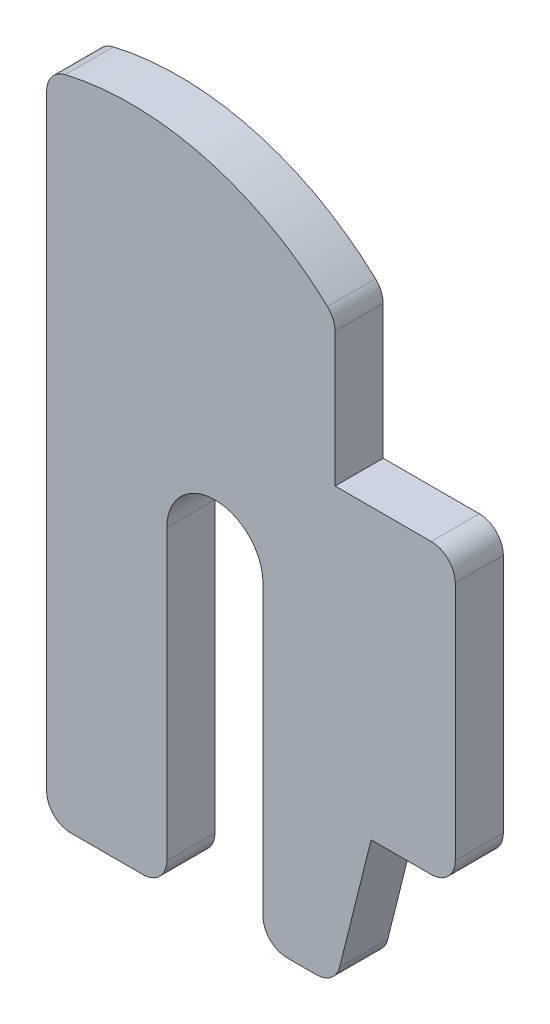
SolidWorks part; units mm, degrees
ref_plane "Plano frontal" through (0, 0, 0) normal (0, 0, 1) x (1, 0, 0)
ref_plane "Plano superior" through (0, 0, 0) normal (0, 1, 0) x (1, 0, 0)
ref_plane "Plano direito" through (0, 0, 0) normal (1, 0, 0) x (0, 0, -1)
sketch "Esboço1" plane through (0, 0, 0) normal (0, 0, 1) x (1, 0, 0)
  line L0 (0, 1) -> (0, 26.2343)
  line L1 (12, 23.5758) -> (12, 18)
  line L2 (12, 18) -> (16, 18)
  line L3 (17, 17) -> (17, 7)
  line L4 (16, 6) -> (13.5, 6)
  line L5 (13.5, 6) -> (12.1894, 0.7575)
  line L6 (11.2192, 0) -> (10, 0)
  line L7 (1, 0) -> (4, 0)
  line L8 (7, 0) -> (7, 13) construction
  line L9 (5, 1) -> (5, 13)
  line L10 (9, 1) -> (9, 13)
  arc A0 (0.7722, 27.208) -> (11.6813, 24.3078) centre (3.5059, 15.5236) cw
  arc A1 (0, 1) -> (1, 0) centre (1, 1) ccw
  arc A2 (9, 13) -> (5, 13) centre (7, 13) ccw
  arc A3 (4, 0) -> (5, 1) centre (4, 1) ccw
  arc A4 (10, 0) -> (9, 1) centre (10, 1) cw
  arc A5 (12.1894, 0.7575) -> (11.2192, 0) centre (11.2192, 1) cw
  arc A6 (17, 7) -> (16, 6) centre (16, 7) cw
  arc A7 (16, 18) -> (17, 17) centre (16, 17) cw
  arc A8 (0, 26.2343) -> (0.7722, 27.208) centre (1, 26.2343) cw
  arc A9 (11.6813, 24.3078) -> (12, 23.5758) centre (11, 23.5758) cw
  point P14 (7, 6.5)
  point P19 (0, 0)
  point P24 (9, 0)
  point P27 (12, 0)
  point P30 (17, 6)
  point P35 (0, 27)
  point P38 (12, 24)
  dimension "D12" = 12
  dimension "D13" = 1
  dimension "D1" = 27
  dimension "D2" = 24
  dimension "D3" = 12
  dimension "D4" = 18
  dimension "D5" = 12
  dimension "D6" = 17
  dimension "D7" = 12
  dimension "D8" = 4
  dimension "D9" = 5
  dimension "D10" = 3.5
  dimension "D11" = 15
extrude "Ressalto-extrusão1" add sketch "Esboço1" along normal blind 2
